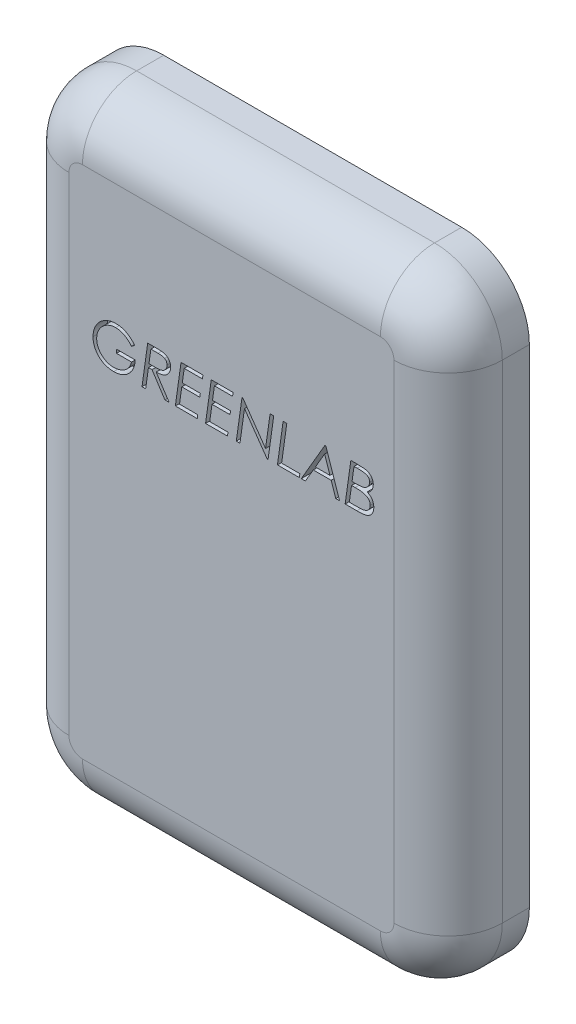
SolidWorks part; units mm, degrees
ref_plane "Front Plane" through (0, 0, 0) normal (0, 0, 1) x (1, 0, 0)
ref_plane "Top Plane" through (0, 0, 0) normal (0, 1, 0) x (1, 0, 0)
ref_plane "Right Plane" through (0, 0, 0) normal (1, 0, 0) x (0, 0, -1)
sketch "Sketch1" plane through (0, 0, 0) normal (0, 0, 1) x (1, 0, 0)
  line L1 (0, 0) -> (16, 0)
  line L2 (0, 0) -> (0, 23)
  line L3 (0, 23) -> (16, 23)
  line L4 (16, 0) -> (16, 23)
  dimension "D1" = 16
  dimension "D2" = 23
extrude "Boss-Extrude1" add sketch "Sketch1" along normal blind 3
fillet "Fillet1" radius 2 4 edges at (8, 0, 3) (16, 11.5, 3) (0, 11.5, 3) (8, 23, 3)
sketch "Sketch2" plane through (0, 0, 3) normal (0, 0, 1) x (1, 0, 0)
  line L0 (2.5492, 15) -> (13.6166, 15) construction
  line L3 (0, 23) -> (16, 23) construction
  text T0 "GREENLAB" font "Century Gothic" height 1.5
  dimension "D1" = 8
extrude "Cut-Extrude1" cut sketch "Sketch2" against normal blind 0.5
fillet "Fillet2" radius 2.5 8 edges at (0.5858, 22.4142, 2.4142) (15.4142, 22.4142, 2.4142) (0.5858, 0.5858, 2.4142) (15.4142, 0.5858, 2.4142) (0, 23, 0.5) (16, 23, 0.5) (0, 0, 0.5) (16, 0, 0.5)
